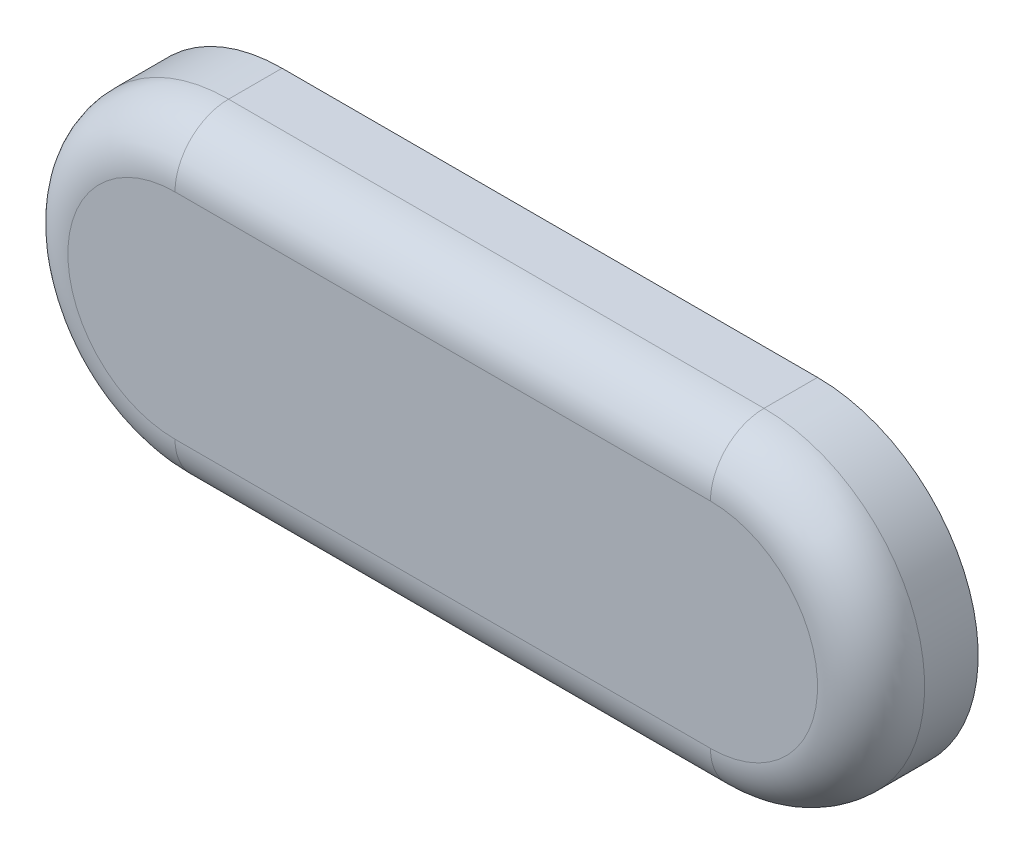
SolidWorks part; units mm, degrees
ref_plane "Plan de face" through (0, 0, 0) normal (0, 0, 1) x (1, 0, 0)
ref_plane "Plan de dessus" through (0, 0, 0) normal (0, 1, 0) x (1, 0, 0)
ref_plane "Plan de droite" through (0, 0, 0) normal (1, 0, 0) x (0, 0, -1)
sketch "Esquisse1" plane through (0, 0, 0) normal (0, 0, 1) x (1, 0, 0)
  line L2 (-5, -26.375) -> (5, -26.375)
  line L3 (5, -20.375) -> (-5, -20.375)
  line L4 (-5, -26.375) -> (5, -26.375)
  line L5 (5, -20.375) -> (-5, -20.375)
  arc A2 (-5, -20.375) -> (-5, -26.375) centre (-5, -23.375) ccw
  arc A3 (5, -26.375) -> (5, -20.375) centre (5, -23.375) ccw
  arc A4 (-5, -20.375) -> (-5, -26.375) centre (-5, -23.375) ccw
  arc A5 (5, -26.375) -> (5, -20.375) centre (5, -23.375) ccw
  dimension "D1" = 0
extrude "Boss.-Extru.1" add sketch "Esquisse1" along normal blind 2
fillet "Congé1" radius 1 4 edges at (0, -26.375, 2) (-8, -23.375, 2) (0, -20.375, 2) (8, -23.375, 2)
